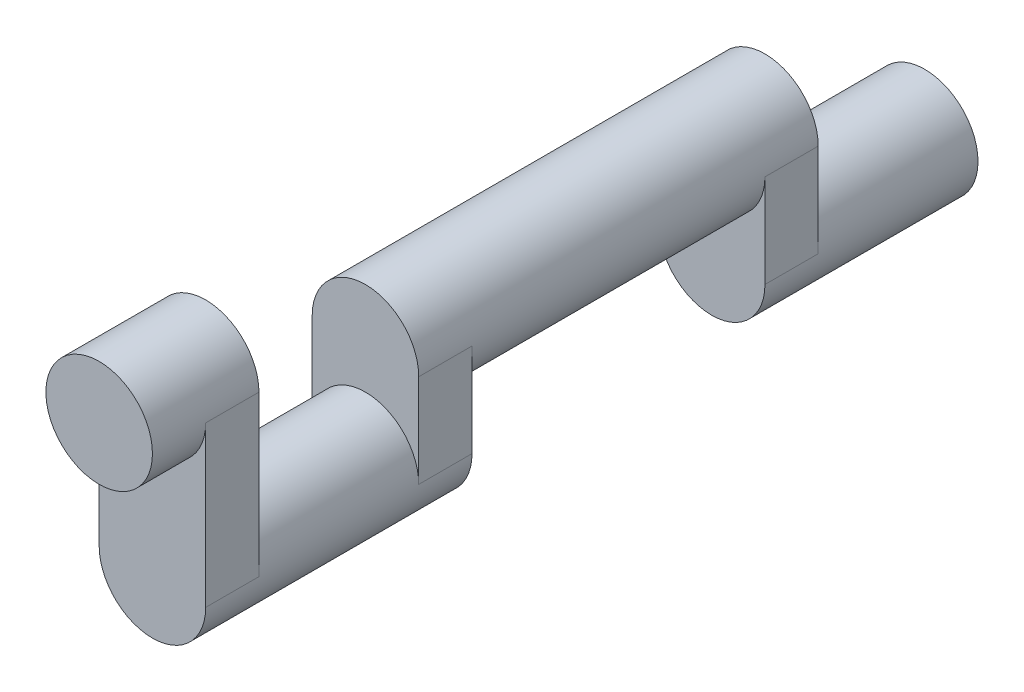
SolidWorks part; units mm, degrees
ref_plane "Front Plane" through (0, 0, 0) normal (0, 0, 1) x (1, 0, 0)
ref_plane "Top Plane" through (0, 0, 0) normal (0, 1, 0) x (1, 0, 0)
ref_plane "Right Plane" through (0, 0, 0) normal (1, 0, 0) x (0, 0, -1)
sketch "Sketch1" plane through (0, 0, 0) normal (0, 0, 1) x (1, 0, 0)
  circle A0 centre (0, 0) radius 25.4
  dimension "D1" = 50.8
extrude "Extrude1" add sketch "Sketch1" against normal blind 25.4
sketch "Sketch2" plane through (0, 0, -25.4) normal (0, 0, -1) x (-1, 0, 0)
  line L0 (-25.4, 0) -> (-25.4, -76.2)
  line L1 (25.4, -76.2) -> (25.4, 0)
  line L2 (0, 0) -> (0, -76.2) construction
  circle A0 centre (0, 0) radius 25.4 construction
  arc A1 (-25.4, -76.2) -> (25.4, -76.2) centre (0, -76.2) ccw
  arc A2 (25.4, 0) -> (-25.4, 0) centre (0, 0) ccw
  arc A3 (22.153, -63.7741) -> (-22.153, -88.6259) centre (0, -76.2) ccw construction
  dimension "D1" = 76.2
extrude "large offset" add sketch "Sketch2" along normal blind 25.4
sketch "Sketch3" plane through (0, 0, -50.8) normal (0, 0, -1) x (-1, 0, 0)
  circle A0 centre (0, -76.2) radius 25.4
  arc A1 (-25.4, -76.2) -> (25.4, -76.2) centre (0, -76.2) ccw construction
extrude "short cylinder1" add sketch "Sketch3" along normal blind 76.2
sketch "Sketch4" plane through (0, 0, -127) normal (0, 0, -1) x (-1, 0, 0)
  line L0 (-25.4, -76.2) -> (-25.4, -31.75)
  line L1 (25.4, -31.75) -> (25.4, -76.2)
  line L2 (0, -76.2) -> (0, -31.75) construction
  arc A0 (-25.4, -31.75) -> (25.4, -31.75) centre (0, -31.75) cw
  circle A1 centre (0, -76.2) radius 25.4
  arc A2 (-25.4, -76.2) -> (25.4, -76.2) centre (0, -76.2) ccw
  arc A5 (60.9208, -42.0286) -> (-60.9208, -110.3714) centre (0, -76.2) ccw
  circle A6 centre (0, -76.2) radius 69.85 construction
  dimension "D2" = 6.35
  dimension "D3" = 25.4
  dimension "D1" = 0
extrude "small offset1" add sketch "Sketch4" along normal blind 25.4
sketch "Sketch5" plane through (0, 0, -127) normal (0, 0, -1) x (-1, 0, 0)
  circle A0 centre (0, -31.75) radius 25.4
extrude "long cylinder" add sketch "Sketch5" along normal blind 190.5
sketch "Sketch6" plane through (0, 0, -317.5) normal (0, 0, -1) x (-1, 0, 0)
  line L0 (25.4, -31.75) -> (25.4, -76.2)
  line L1 (-25.4, -76.2) -> (-25.4, -31.75)
  line L2 (0, -76.2) -> (0, -31.75) construction
  arc A0 (25.4, -76.2) -> (-25.4, -76.2) centre (0, -76.2) cw
  circle A1 centre (0, -31.75) radius 25.4
  arc A2 (25.4, -31.75) -> (-25.4, -31.75) centre (0, -31.75) ccw
  arc A3 (-25.4, -76.2) -> (25.4, -76.2) centre (0, -76.2) ccw construction
  arc A4 (22.153, -63.7741) -> (-22.153, -88.6259) centre (0, -76.2) ccw construction
  dimension "D1" = 0
extrude "small offset2" add sketch "Sketch6" against normal blind 25.4
sketch "Sketch7" plane through (0, 0, -317.5) normal (0, 0, 1) x (1, 0, 0)
  circle A0 centre (0, -76.2) radius 25.4
extrude "short cylinder2" add sketch "Sketch7" against normal blind 76.2
